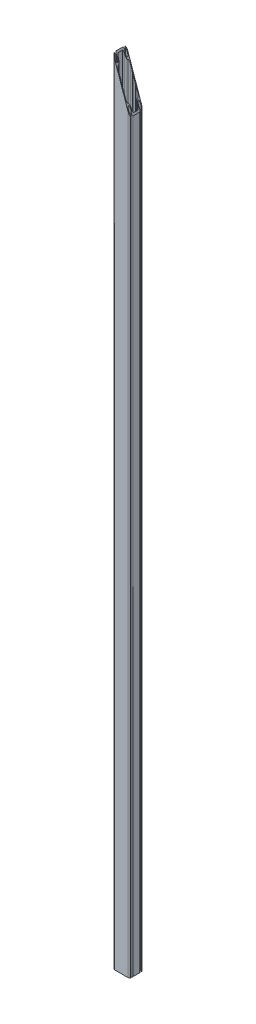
SolidWorks part; units mm, degrees
ref_plane "Alzado" through (0, 0, 0) normal (0, 0, 1) x (1, 0, 0)
ref_plane "Planta" through (0, 0, 0) normal (0, 1, 0) x (1, 0, 0)
ref_plane "Vista lateral" through (0, 0, 0) normal (1, 0, 0) x (0, 0, -1)
sketch "Croquis1" plane through (0, 0, 0) normal (0, 1, 0) x (1, 0, 0)
  line L0 (0, -75.4262) -> (0, 70.5479) construction
  line L1 (-123.9156, -11.6543) -> (129.4204, -11.6543) construction
  line L6 (39.5, 1.486) -> (39.5, 34.9397) construction
  line L7 (19.5039, 17.8457) -> (63.5704, 17.8457) construction
  line L9 (46, -42.8837) -> (46, -42.6992)
  line L10 (22.5, 24.3457) -> (12.5, 24.3457)
  line L12 (39.5, 17.8457) -> (50.0765, 20.3595) construction
  line L13 (47.3463, 21.5924) -> (48.0388, 18.6787) construction
  line L14 (47.3463, -44.9011) -> (48.0388, -41.9874) construction
  line L15 (39.5, -41.1543) -> (50.0765, -43.6682) construction
  line L16 (19.5039, -41.1543) -> (63.5704, -41.1543) construction
  line L17 (39.5, -24.7947) -> (39.5, -58.2483) construction
  line L19 (46, 19.5751) -> (46, 19.3906)
  line L20 (39.5, -51.6543) -> (-39.5, -51.6543)
  line L21 (11, 22.8457) -> (12.5, 24.3457)
  line L22 (46, -24.1543) -> (46, 0.8457)
  line L23 (50, -31.9348) -> (50, 8.6261)
  line L24 (-39.5, -24.7947) -> (-39.5, -58.2483) construction
  line L25 (-19.5039, -41.1543) -> (-63.5704, -41.1543) construction
  line L26 (-39.5, -41.1543) -> (-50.0765, -43.6682) construction
  line L27 (-47.3463, -44.9011) -> (-48.0388, -41.9874) construction
  line L28 (-47.3463, 21.5924) -> (-48.0388, 18.6787) construction
  line L29 (-39.5, 17.8457) -> (-50.0765, 20.3595) construction
  line L30 (-19.5039, 17.8457) -> (-63.5704, 17.8457) construction
  line L31 (-39.5, 1.486) -> (-39.5, 34.9397) construction
  line L32 (123.9156, -11.6543) -> (-129.4204, -11.6543) construction
  line L33 (-50, -31.9348) -> (-50, 8.6261)
  line L34 (-46, -24.1543) -> (-46, 0.8457)
  line L35 (-50, 28.3457) -> (-50, -31.9348)
  line L36 (-39.5, -51.6543) -> (39.5, -51.6543)
  line L38 (-22.5, -47.6543) -> (-12.5, -47.6543)
  line L39 (-22.5, 24.3457) -> (-12.5, 24.3457)
  line L40 (-46, -42.8837) -> (-46, -42.6992)
  line L41 (-39.5, 28.3457) -> (39.5, 28.3457)
  line L42 (46, 0.8457) -> (46, -24.1543)
  line L43 (50, 8.6261) -> (50, -31.9348)
  line L44 (8, 22.8457) -> (6.5, 24.3457)
  line L45 (11, 22.8457) -> (8, 22.8457)
  line L46 (-11, 22.8457) -> (-8, 22.8457)
  line L47 (-8, 22.8457) -> (-6.5, 24.3457)
  line L48 (-11, 22.8457) -> (-12.5, 24.3457)
  line L49 (11, -46.1543) -> (8, -46.1543)
  line L50 (8, -46.1543) -> (6.5, -47.6543)
  line L51 (11, -46.1543) -> (12.5, -47.6543)
  line L52 (-11, -46.1543) -> (-12.5, -47.6543)
  line L53 (-8, -46.1543) -> (-6.5, -47.6543)
  line L54 (-11, -46.1543) -> (-8, -46.1543)
  line L55 (-6.5, -47.6543) -> (6.5, -47.6543)
  line L56 (12.5, -47.6543) -> (22.5, -47.6543)
  line L57 (-12.5, 24.3457) -> (-22.5, 24.3457)
  line L58 (6.5, 24.3457) -> (-6.5, 24.3457)
  line L59 (-6.5, 24.3457) -> (6.5, 24.3457)
  line L60 (12.5, 24.3457) -> (22.5, 24.3457)
  line L61 (-46, 0.8457) -> (-46, -24.1543)
  arc A0 (49.242, 21.7627) -> (39.5, 28.3457) centre (39.5, 17.8457) ccw
  arc A1 (45.5308, 20.2705) -> (43.0455, 12.3978) centre (39.5, 17.8457) ccw
  arc A5 (45.5308, 20.2705) -> (49.242, 21.7627) centre (47.3864, 21.0166) ccw
  arc A6 (29, 17.8457) -> (22.5, 24.3457) centre (22.5, 17.8457) ccw
  arc A7 (46, 0.8457) -> (39.5, 7.3457) centre (39.5, 0.8457) ccw
  arc A9 (50, 8.6261) -> (43.0455, 12.3978) centre (45.5, 8.6261) ccw
  arc A10 (50, -31.9348) -> (43.0455, -35.7064) centre (45.5, -31.9348) cw
  arc A11 (46, -24.1543) -> (39.5, -30.6543) centre (39.5, -24.1543) cw
  arc A12 (29, -41.1543) -> (22.5, -47.6543) centre (22.5, -41.1543) cw
  arc A13 (45.5308, -43.5791) -> (49.242, -45.0713) centre (47.3864, -44.3252) cw
  arc A14 (45.5308, -43.5791) -> (43.0455, -35.7064) centre (39.5, -41.1543) cw
  arc A15 (49.242, -45.0713) -> (39.5, -51.6543) centre (39.5, -41.1543) cw
  arc A16 (29, -41.1543) -> (39.5, -30.6543) centre (39.5, -41.1543) cw
  arc A17 (29, 17.8457) -> (39.5, 7.3457) centre (39.5, 17.8457) ccw
  arc A18 (-29, 17.8457) -> (-39.5, 7.3457) centre (-39.5, 17.8457) cw
  arc A19 (-29, -41.1543) -> (-39.5, -30.6543) centre (-39.5, -41.1543) ccw
  arc A20 (-49.242, -45.0713) -> (-39.5, -51.6543) centre (-39.5, -41.1543) ccw
  arc A21 (-45.5308, -43.5791) -> (-43.0455, -35.7064) centre (-39.5, -41.1543) ccw
  arc A22 (-45.5308, -43.5791) -> (-49.242, -45.0713) centre (-47.3864, -44.3252) ccw
  arc A23 (-29, -41.1543) -> (-22.5, -47.6543) centre (-22.5, -41.1543) ccw
  arc A24 (-46, -24.1543) -> (-39.5, -30.6543) centre (-39.5, -24.1543) ccw
  arc A25 (-50, -31.9348) -> (-43.0455, -35.7064) centre (-45.5, -31.9348) ccw
  arc A26 (-50, 8.6261) -> (-43.0455, 12.3978) centre (-45.5, 8.6261) cw
  arc A27 (-46, 0.8457) -> (-39.5, 7.3457) centre (-39.5, 0.8457) cw
  arc A28 (-29, 17.8457) -> (-22.5, 24.3457) centre (-22.5, 17.8457) cw
  arc A29 (-45.5308, 20.2705) -> (-49.242, 21.7627) centre (-47.3864, 21.0166) cw
  arc A30 (-45.5308, 20.2705) -> (-43.0455, 12.3978) centre (-39.5, 17.8457) cw
  arc A31 (-49.242, 21.7627) -> (-39.5, 28.3457) centre (-39.5, 17.8457) cw
  dimension "D8" = 2
  dimension "D9" = 13
  dimension "D12" = 4.5
  dimension "D2" = 8
  dimension "D3" = 11.6543
  dimension "D4" = 3
  dimension "D5" = 45
  dimension "D6" = 45
  dimension "D10" = 13.37
  dimension "D11" = 8.5
  dimension "D13" = 3.1709
  dimension "D14" = 9.2195
extrude "Saliente-Extruir1" add sketch "Croquis1" along normal blind 4753 contours A31 A29 A30 A26 L33 A25 A21 A22 A20 L20 A15 A13 A14 A10 L23 A9 A1 A5 A0 L41 A18 A28 L39 L48 L46 L47 L58 L44 L45 L21 L10 A6 A17 A7 L22 A11 A16 A12 L56 L51 L49 L50 L55 L53 L54 L52 L38
sketch "Croquis2" plane through (0, 0, 51.6543) normal (0, 0, 1) x (1, 0, 0)
  line L0 (-50, 4753) -> (-49.242, 4772.6303) construction
  line L1 (-49.242, 4753) -> (-49.242, 0) construction
  line L2 (-50, 4753) -> (191.6317, 4753) construction
  line L3 (-50, 4753) -> (50, 4464.5429)
  line L5 (-50, 4753) -> (50, 4753)
  line L7 (50, 4753) -> (50, 0) construction
  line L8 (50, 4753) -> (50, 4464.5429)
  dimension "D1" = 70.88
extrude "Cortar-Extruir1" cut sketch "Croquis2" against normal through all
